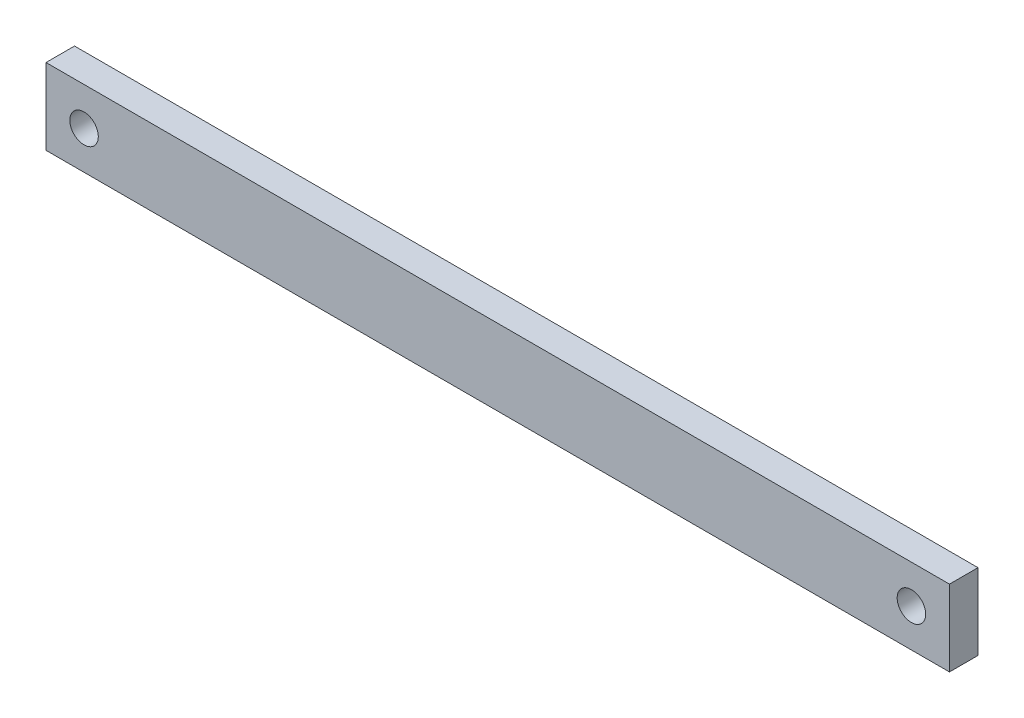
SolidWorks part; units mm, degrees
ref_plane "Plan de face" through (0, 0, 0) normal (0, 0, 1) x (1, 0, 0)
ref_plane "Plan de dessus" through (0, 0, 0) normal (0, 1, 0) x (1, 0, 0)
ref_plane "Plan de droite" through (0, 0, 0) normal (1, 0, 0) x (0, 0, -1)
sketch "Esquisse1" plane through (0, 0, 0) normal (0, 0, 1) x (1, 0, 0)
  line L0 (0, 0) -> (87, 87) construction
  line L1 (0, 0) -> (87, 0) construction
  line L2 (0, 0) -> (0, 87) construction
  line L3 (0, 87) -> (87, 87) construction
  line L4 (87, 0) -> (87, 87) construction
  line L5 (-4, 4.1007) -> (-4, -7.1235) construction
  line L6 (-6, -4) -> (93.9133, -4) construction
  line L7 (91, -7.1235) -> (91, 4.1007) construction
  line L9 (93.9133, 4) -> (-7.4978, 4) construction
  line L10 (-4, 4) -> (91, 4)
  line L11 (-4, 4) -> (-4, -4)
  line L12 (-4, -4) -> (91, -4)
  line L13 (91, 4) -> (91, -4)
  circle A0 centre (0, 0) radius 1.5
  circle A1 centre (87, 0) radius 1.5
  dimension "D1" = 4
  dimension "D2" = 8
extrude "Extrusion1" add sketch "Esquisse1" along normal blind 3
